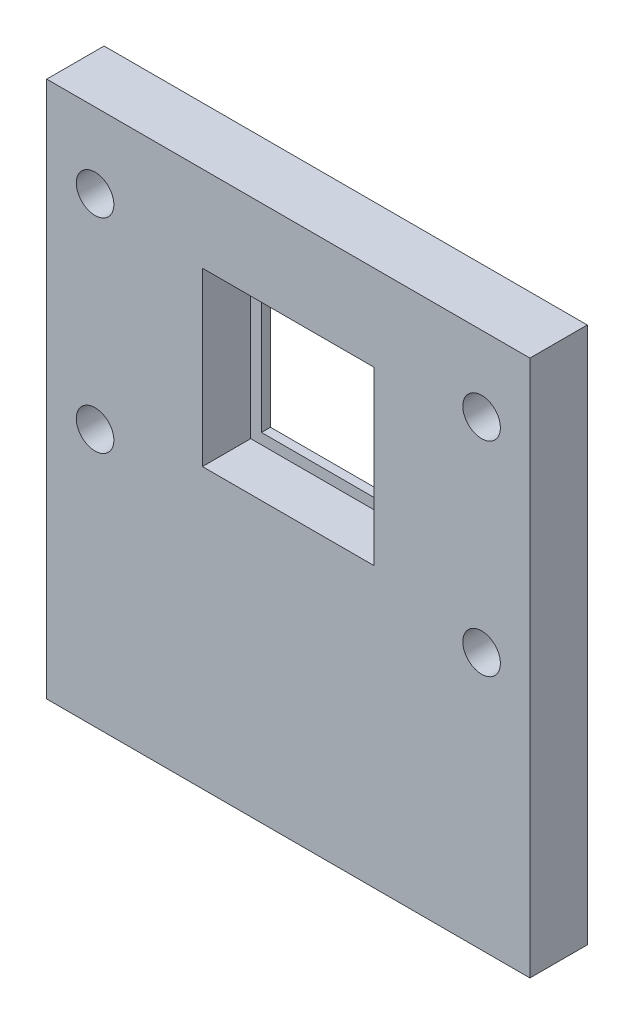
SolidWorks part; units mm, degrees
ref_plane "Front Plane" through (0, 0, 0) normal (0, 0, 1) x (1, 0, 0)
ref_plane "Top Plane" through (0, 0, 0) normal (0, 1, 0) x (1, 0, 0)
ref_plane "Right Plane" through (0, 0, 0) normal (1, 0, 0) x (0, 0, -1)
sketch "Sketch1" plane through (0, 0, 0) normal (0, 0, 1) x (1, 0, 0)
  line L1 (22.5, -25) -> (-22.5, -25)
  line L2 (22.5, -25) -> (22.5, 25)
  line L3 (22.5, 25) -> (-22.5, 25)
  line L4 (-22.5, -25) -> (-22.5, 25)
  line L5 (22.5, -25) -> (-22.5, 25) construction
  line L6 (22.5, 25) -> (-22.5, -25) construction
  point P0 (0, 0)
  dimension "D1" = 50
  dimension "D2" = 45
extrude "Boss-Extrude1" add sketch "Sketch1" along normal blind 8.34
sketch "Sketch2" plane through (0, 0, 8.34) normal (0, 0, 1) x (1, 0, 0)
  line L2 (-8, 1) -> (8, 1)
  line L3 (-8, 1) -> (-8, 17)
  line L4 (-8, 17) -> (8, 17)
  line L5 (8, 1) -> (8, 17)
  line L6 (-8, 1) -> (8, 17) construction
  line L7 (-8, 17) -> (8, 1) construction
  point P0 (0, 9)
  dimension "D2" = 9
  dimension "D1" = 16
extrude "Cut-Extrude1" cut sketch "Sketch2" against normal blind 4.5
sketch "Sketch5" plane through (0, 0, 0) normal (0, 0, -1) x (-1, 0, 0)
  line L0 (-22.5, 25) -> (22.5, 25) construction
  line L1 (22.5, 25) -> (22.5, -25) construction
  line L2 (22.5, -25) -> (-22.5, -25)
  line L3 (22.5, -25) -> (22.5, 25)
  line L4 (22.5, 25) -> (-22.5, 25)
  line L5 (-22.5, -25) -> (-22.5, 25)
  line L6 (22.5, -25) -> (-22.5, 25) construction
  line L7 (22.5, 25) -> (-22.5, -25) construction
  line L8 (22.5, -25) -> (-22.5, -25) construction
  point P0 (0, 0)
  point P4 (0, 0)
extrude "Cut-Extrude3" cut sketch "Sketch5" against normal blind 3
hole_wizard "M2x0.4 Tapped Hole1" positions "Sketch7" profile "Sketch6" tap size "M2x0.4" standard "ANSI Metric"
sketch "Sketch7" plane through (0, 0, 0) normal (0, 0, -1) x (-1, 0, 0)
  line L0 (-7, 22) -> (7, 22) construction
  line L3 (0, 22) -> (0, 0) construction
  line L4 (-15, 25) -> (15, 25) construction
  point P0 (-7, 22)
  point P2 (7, 22)
  point P4 (0, -2)
  dimension "D1" = 7
  dimension "D2" = 24
  dimension "D3" = 3
sketch "Sketch6" plane through (7, 22, 0) normal (1, 0, 0) x (0, 1, 0)
  line L0 (0, 0) -> (0, 5.6807)
  line L1 (0, 5.6807) -> (0.8, 5.2)
  line L2 (0.8, 5.2) -> (0.8, 0)
  line L5 (0.8, 0) -> (0, 0)
  line L10 (0, 5.6807) -> (-0.8, 5.2) construction
  line L11 (0, -6.35) -> (0, 107.95) construction
  dimension "Tap Drill Dia." = 1.6
  dimension "Tap Drill Depth" = 5.2
  dimension "Drill Angle" = 118
sketch "Sketch13" plane through (0, 0, 3) normal (0, 0, -1) x (-1, 0, 0)
  line L0 (22.5, 25) -> (-22.5, 25) construction
  line L1 (18, 18) -> (0, 18) construction
  line L2 (0, 18) -> (-18, 18) construction
  circle A0 centre (-18, 18) radius 1.75
  circle A1 centre (18, 18) radius 1.75
  circle A2 centre (18, -1) radius 1.75
  circle A3 centre (-18, -1) radius 1.75
  point P0 (0, 18)
  dimension "D2" = 3.5
  dimension "D1" = 7
  dimension "D3" = 18
  dimension "D4" = 19
extrude "Cut-Extrude5" cut sketch "Sketch13" against normal up to next
sketch "Sketch16" plane through (0, 0, 3.84) normal (0, 0, 1) x (1, 0, 0)
  line L1 (-7, 16) -> (7, 16)
  line L2 (-7, 16) -> (-7, 2)
  line L3 (-7, 2) -> (7, 2)
  line L4 (7, 16) -> (7, 2)
  line L5 (-7, 1) -> (7, 1) construction
  line L6 (8, 2) -> (8, 16) construction
  dimension "D1" = 14
  dimension "D2" = 1
  dimension "D3" = 1
extrude "Cut-Extrude8" cut sketch "Sketch16" against normal through all
